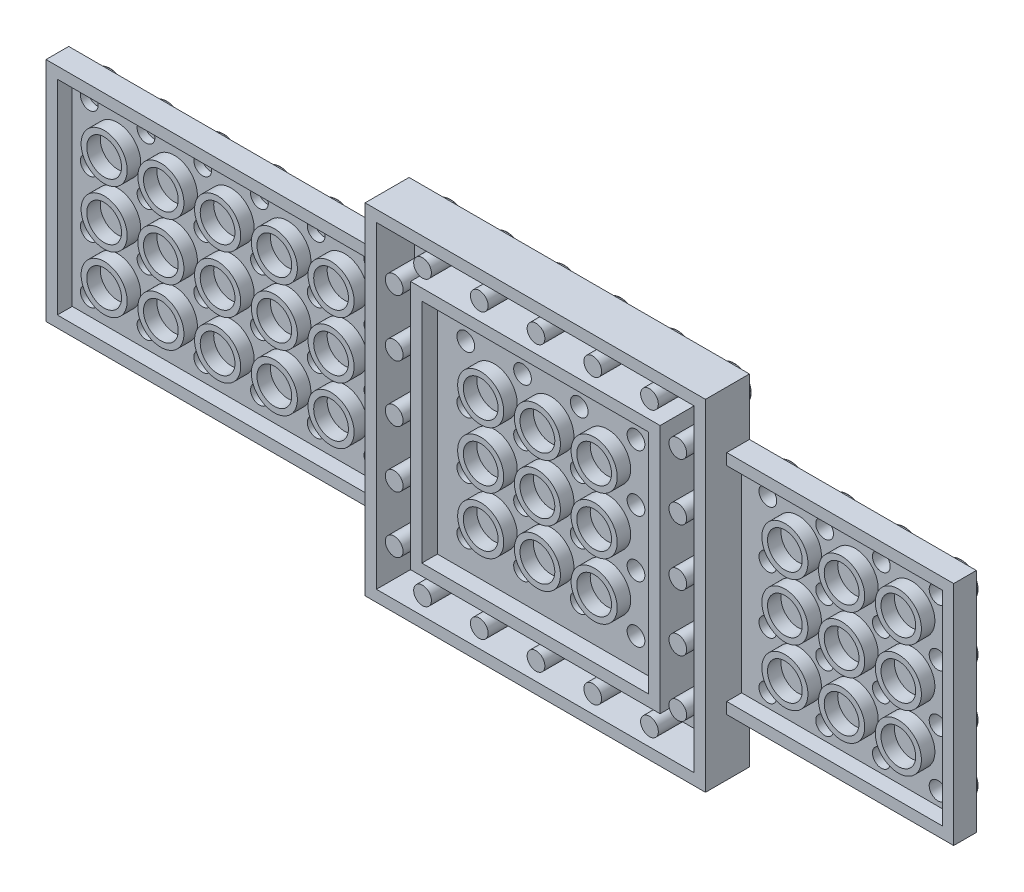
SolidWorks part; units mm, degrees
ref_plane "Vorne" through (0, 0, 0) normal (0, 0, 1) x (1, 0, 0)
ref_plane "Oben" through (0, 0, 0) normal (0, 1, 0) x (1, 0, 0)
ref_plane "Rechts" through (0, 0, 0) normal (1, 0, 0) x (0, 0, -1)
sketch "Skizze1" plane through (0, 0, 0) normal (0, 0, 1) x (1, 0, 0)
  line L0 (-31.7, 0.5) -> (-31.7, -7.5)
  line L1 (-31.7, 0.5) -> (-79.7, 0.5)
  line L2 (0.3, -7.5) -> (0.3, -39.5)
  line L3 (-31.7, -47.5) -> (-79.7, -47.5)
  line L4 (-127.7, -7.5) -> (-127.7, -39.5)
  line L5 (-31.7, -7.5) -> (0.3, -7.5)
  line L6 (-79.7, 0.5) -> (-79.7, -7.5)
  line L7 (-79.7, -7.5) -> (-127.7, -7.5)
  line L9 (-31.7, -39.5) -> (0.3, -39.5)
  line L10 (-31.7, -47.5) -> (-31.7, -39.5)
  line L11 (-79.7, -39.5) -> (-127.7, -39.5)
  line L12 (-79.7, -47.5) -> (-79.7, -39.5)
  dimension "D1" = 128
  dimension "D2" = 8
  dimension "D3" = 8
  dimension "D4" = 32
  dimension "D5" = 8
  dimension "D6" = 48
  dimension "D7" = 32
  dimension "D8" = 8
  dimension "D9" = 32
  dimension "D10" = 48
extrude "Linear austragen1" add sketch "Skizze1" along normal blind 3.2
sketch "Skizze2" plane through (0, 0, 3.2) normal (0, 0, 1) x (1, 0, 0)
  line L1 (-1.3, -37.9) -> (-33.3, -37.9)
  line L2 (-1.3, -37.9) -> (-1.3, -9.1)
  line L3 (-1.3, -9.1) -> (-33.3, -9.1)
  line L4 (-126.1, -37.9) -> (-126.1, -9.1)
  line L5 (0.3, -39.5) -> (0.3, -7.5) construction
  line L7 (0.3, -7.5) -> (-31.7, -7.5) construction
  line L9 (-31.7, -39.5) -> (0.3, -39.5) construction
  line L11 (-127.7, -7.5) -> (-127.7, -39.5) construction
  line L12 (-33.3, -9.1) -> (-33.3, -1.1)
  line L13 (-33.3, -1.1) -> (-78.1, -1.1)
  line L14 (-78.1, -1.1) -> (-78.1, -9.1)
  line L15 (-33.3, -37.9) -> (-33.3, -45.9)
  line L16 (-33.3, -45.9) -> (-78.1, -45.9)
  line L17 (-78.1, -45.9) -> (-78.1, -37.9)
  line L18 (-31.7, -7.5) -> (-31.7, 0.5) construction
  line L19 (-79.7, 0.5) -> (-79.7, -7.5) construction
  line L20 (-31.7, 0.5) -> (-79.7, 0.5) construction
  line L21 (-79.7, -47.5) -> (-31.7, -47.5) construction
  line L22 (-78.1, -37.9) -> (-126.1, -37.9)
  line L23 (-78.1, -9.1) -> (-126.1, -9.1)
  dimension "D1" = 1.6
  dimension "D2" = 1.6
  dimension "D3" = 1.6
  dimension "D4" = 1.6
  dimension "D5" = 1.6
  dimension "D6" = 1.6
  dimension "D7" = 1.6
  dimension "D8" = 1.6
extrude "Schnitt-Linear austragen1" cut sketch "Skizze2" against normal blind 2.1
sketch "Skizze3" plane through (0, 0, 1.1) normal (0, 0, 1) x (1, 0, 0)
  line L0 (0.3, -39.5) -> (0.3, -7.5) construction
  line L2 (0.3, -7.5) -> (-31.7, -7.5) construction
  circle A0 centre (-7.7, -15.5) radius 3.25
  circle A1 centre (-7.7, -15.5) radius 2.45
  dimension "D1" = 6.5
  dimension "D2" = 4.9
  dimension "D3" = 8
  dimension "D4" = 8
extrude "Linear austragen2" add sketch "Skizze3" along normal blind 1.9
sketch "Skizze4" plane through (0, 0, 0) normal (0, 0, -1) x (-1, 0, 0)
  line L1 (-0.3, -39.5) -> (-0.3, -7.5) construction
  line L2 (-0.3, -7.5) -> (31.7, -7.5) construction
  circle A0 centre (3.7, -11.5) radius 2.45
  dimension "D1" = 4.9
  dimension "D2" = 4
  dimension "D3" = 4
extrude "Linear austragen3" add sketch "Skizze4" along normal blind 1.9
fillet "Verrundung1" radius 0.2 1 edges at (-6.15, -11.5, -1.9)
sketch "Skizze5" plane through (0, 0, 1.1) normal (0, 0, 1) x (1, 0, 0)
  circle A0 centre (-4, -12) radius 1.25
  dimension "D1" = 2.5
extrude "Schnitt-Linear austragen2" cut sketch "Skizze5" against normal blind 1.8
pattern_linear "Lineares Muster1" count 4 spacing 8 along (0, -1, 0) count 4 spacing 8 along (-1, 0, 0) of "Schnitt-Linear austragen2", "Verrundung1", "Linear austragen3"
pattern_linear "Lineares Muster4" count 3 spacing 8 along (0, -1, 0) count 3 spacing 8 along (-1, 0, 0) of "Linear austragen2"
sketch "Skizze6" plane through (0, 0, 1.1) normal (0, 0, 1) x (1, 0, 0)
  line L0 (-127.7, -7.5) -> (-127.7, -39.5) construction
  line L1 (-79.7, -7.5) -> (-127.7, -7.5) construction
  circle A0 centre (-123.7, -11.5) radius 1.25
  dimension "D1" = 2.5
  dimension "D2" = 4
  dimension "D3" = 4
extrude "Schnitt-Linear austragen3" cut sketch "Skizze6" against normal blind 1.8
sketch "Skizze7" plane through (0, 0, 0) normal (0, 0, -1) x (-1, 0, 0)
  line L0 (127.7, -7.5) -> (127.7, -39.5) construction
  line L1 (79.7, -7.5) -> (127.7, -7.5) construction
  circle A0 centre (123.7, -11.5) radius 2.45
  dimension "D1" = 4.9
  dimension "D2" = 4
  dimension "D3" = 4
extrude "Linear austragen4" add sketch "Skizze7" along normal blind 1.9
fillet "Verrundung2" radius 0.2 1 edges at (-126.15, -11.5, -1.9)
pattern_linear "Lineares Muster5" count 4 spacing 8 along (0, -1, 0) count 6 spacing 8 along (1, 0, 0) of "Verrundung2", "Linear austragen4", "Schnitt-Linear austragen3"
sketch "Skizze8" plane through (0, 0, 1.1) normal (0, 0, 1) x (1, 0, 0)
  line L0 (-127.7, -39.5) -> (-79.7, -39.5) construction
  line L1 (-127.7, -7.5) -> (-127.7, -39.5) construction
  circle A0 centre (-119.7, -31.5) radius 3.25
  circle A1 centre (-119.7, -31.5) radius 2.45
  dimension "D1" = 6.5
  dimension "D2" = 4.9
  dimension "D3" = 8
  dimension "D4" = 8
extrude "Linear austragen5" add sketch "Skizze8" along normal blind 1.9
pattern_linear "Lineares Muster6" count 3 spacing 8 along (0, 1, 0) count 5 spacing 8 along (1, 0, 0) of "Linear austragen5"
sketch "Skizze9" plane through (0, 0, 0) normal (0, 0, -1) x (-1, 0, 0)
  line L0 (79.7, -47.5) -> (31.7, -47.5) construction
  line L1 (31.7, 0.5) -> (79.7, 0.5) construction
  line L5 (71.7, -7.5) -> (39.7, -7.5)
  line L6 (71.7, -7.5) -> (71.7, -39.5)
  line L7 (71.7, -39.5) -> (39.7, -39.5)
  line L8 (39.7, -7.5) -> (39.7, -39.5)
  line L9 (31.7, -47.5) -> (31.7, -39.5) construction
  line L10 (79.7, -39.5) -> (79.7, -47.5) construction
  point P10 (31.7, -43.5)
  dimension "D1" = 8
  dimension "D2" = 8
  dimension "D3" = 8
  dimension "D4" = 8
extrude "Schnitt-Linear austragen4" cut sketch "Skizze9" against normal blind 3.2
sketch "Skizze10" plane through (0, 0, 1.1) normal (0, 0, 1) x (1, 0, 0)
  line L0 (-78.1, -1.1) -> (-78.1, -9.1) construction
  line L1 (-79.7, 0.5) -> (-31.7, 0.5)
  line L2 (-79.7, 0.5) -> (-79.7, -47.5)
  line L3 (-79.7, -47.5) -> (-31.7, -47.5)
  line L4 (-31.7, 0.5) -> (-31.7, -47.5)
  line L5 (-33.3, -1.1) -> (-78.1, -1.1) construction
  line L6 (-33.3, -9.1) -> (-33.3, -1.1) construction
  line L7 (-78.1, -45.9) -> (-33.3, -45.9) construction
  point P7 (-78.1, -5.1)
  dimension "D1" = 1.6
  dimension "D2" = 1.6
  dimension "D3" = 1.6
  dimension "D4" = 1.6
extrude "Linear austragen7" add sketch "Skizze10" along normal blind 5.1
sketch "Skizze11" plane through (0, 0, 6.2) normal (0, 0, 1) x (1, 0, 0)
  line L0 (-31.7, 0.5) -> (-79.7, 0.5) construction
  line L1 (-71.7, -7.5) -> (-39.7, -7.5)
  line L2 (-71.7, -7.5) -> (-71.7, -39.5)
  line L3 (-71.7, -39.5) -> (-39.7, -39.5)
  line L4 (-39.7, -7.5) -> (-39.7, -39.5)
  line L5 (-79.7, -47.5) -> (-31.7, -47.5) construction
  line L6 (-31.7, -47.5) -> (-31.7, 0.5) construction
  line L7 (-79.7, 0.5) -> (-79.7, -47.5) construction
  dimension "D1" = 8
  dimension "D2" = 8
  dimension "D3" = 8
  dimension "D4" = 8
extrude "Schnitt-Linear austragen5" cut sketch "Skizze11" against normal blind 2.2
sketch "Skizze12" plane through (0, 0, 6.2) normal (0, 0, 1) x (1, 0, 0)
  line L0 (-79.7, -47.5) -> (-31.7, -47.5) construction
  line L1 (-73.3, -41.1) -> (-38.1, -41.1)
  line L2 (-73.3, -41.1) -> (-73.3, -5.9)
  line L3 (-73.3, -5.9) -> (-38.1, -5.9)
  line L4 (-38.1, -41.1) -> (-38.1, -5.9)
  line L5 (-78.1, -45.9) -> (-33.3, -45.9)
  line L6 (-78.1, -45.9) -> (-78.1, -1.1)
  line L7 (-78.1, -1.1) -> (-33.3, -1.1)
  line L8 (-33.3, -45.9) -> (-33.3, -1.1)
  line L9 (-79.7, 0.5) -> (-79.7, -47.5) construction
  line L10 (-31.7, -47.5) -> (-31.7, 0.5) construction
  line L11 (-31.7, 0.5) -> (-79.7, 0.5) construction
  line L12 (-39.7, -7.5) -> (-71.7, -7.5) construction
  line L13 (-39.7, -39.5) -> (-39.7, -7.5) construction
  line L14 (-71.7, -39.5) -> (-39.7, -39.5) construction
  line L15 (-71.7, -7.5) -> (-71.7, -39.5) construction
  dimension "D1" = 1.6
  dimension "D2" = 1.6
  dimension "D3" = 1.6
  dimension "D4" = 1.6
  dimension "D5" = 1.6
  dimension "D6" = 1.6
  dimension "D7" = 1.6
  dimension "D8" = 1.6
extrude "Schnitt-Linear austragen6" cut sketch "Skizze12" against normal blind 5.4
sketch "Skizze13" plane through (0, 0, 0) normal (0, 0, -1) x (-1, 0, 0)
  line L0 (79.7, -47.5) -> (31.7, -47.5) construction
  line L1 (31.7, -47.5) -> (31.7, -39.5) construction
  circle A0 centre (35.7, -43.5) radius 2.45
  dimension "D1" = 4.9
  dimension "D3" = 4
  dimension "D2" = 4
extrude "Linear austragen8" add sketch "Skizze13" along normal blind 1.9
fillet "Verrundung3" radius 0.2 1 edges at (-38.15, -43.5, -1.9)
sketch "Skizze14" plane through (0, 0, 0.8) normal (0, 0, 1) x (1, 0, 0)
  line L0 (-79.7, -47.5) -> (-31.7, -47.5) construction
  line L1 (-31.7, -47.5) -> (-31.7, 0.5) construction
  circle A0 centre (-35.7, -43.5) radius 1.25
  dimension "D1" = 2.5
  dimension "D2" = 4
  dimension "D3" = 4
extrude "Schnitt-Linear austragen7" cut sketch "Skizze14" against normal blind 1.8
pattern_linear "Lineares Muster7" count 6 spacing 8 along (0, 1, 0) of "Schnitt-Linear austragen7", "Verrundung3", "Linear austragen8"
pattern_linear "Lineares Muster8" count 6 spacing 8 along (-1, 0, 0) of "Schnitt-Linear austragen7", "Verrundung3", "Linear austragen8"
sketch "Skizze15" plane through (0, 0, 0) normal (0, 0, -1) x (-1, 0, 0)
  line L0 (31.7, 0.5) -> (79.7, 0.5) construction
  line L1 (79.7, 0.5) -> (79.7, -7.5) construction
  circle A0 centre (75.7, -3.5) radius 2.45
  dimension "D1" = 4
  dimension "D2" = 4
extrude "Linear austragen9" add sketch "Skizze15" along normal blind 1.9
fillet "Verrundung4" radius 0.2 1 edges at (-78.15, -3.5, -1.9)
sketch "Skizze16" plane through (0, 0, 0.8) normal (0, 0, 1) x (1, 0, 0)
  line L0 (-31.7, 0.5) -> (-79.7, 0.5) construction
  line L1 (-79.7, 0.5) -> (-79.7, -47.5) construction
  circle A0 centre (-75.7, -3.5) radius 1.25
  dimension "D1" = 4
  dimension "D2" = 4
extrude "Schnitt-Linear austragen8" cut sketch "Skizze16" against normal blind 1.8
pattern_linear "Lineares Muster12" count 5 spacing 8 along (0, -1, 0) of "Schnitt-Linear austragen8", "Verrundung4", "Linear austragen9"
pattern_linear "Lineares Muster13" count 5 spacing 8 along (1, 0, 0) of "Schnitt-Linear austragen8", "Verrundung4", "Linear austragen9"
sketch "Skizze17" plane through (0, 0, 0.8) normal (0, 0, 1) x (1, 0, 0)
  line L0 (-79.7, -47.5) -> (-31.7, -47.5) construction
  line L1 (-79.7, 0.5) -> (-79.7, -47.5) construction
  circle A0 centre (-75.7, -39.5) radius 1.25
  dimension "D1" = 8
  dimension "D3" = 2.5
  dimension "D2" = 4
extrude "Linear austragen10" add sketch "Skizze17" along normal blind 5.3
pattern_linear "Lineares Muster14" count 5 spacing 8 along (0, 1, 0) of "Linear austragen10"
sketch "Skizze18" plane through (0, 0, 0.8) normal (0, 0, 1) x (1, 0, 0)
  line L0 (-31.7, 0.5) -> (-79.7, 0.5) construction
  line L1 (-79.7, 0.5) -> (-79.7, -47.5) construction
  circle A0 centre (-71.7, -3.5) radius 1.25
  dimension "D1" = 4
  dimension "D3" = 2.5
  dimension "D2" = 8
extrude "Linear austragen11" add sketch "Skizze18" along normal blind 5.3
pattern_linear "Lineares Muster15" count 5 spacing 8 along (1, 0, 0) of "Linear austragen11"
sketch "Skizze19" plane through (0, 0, 0.8) normal (0, 0, 1) x (1, 0, 0)
  line L0 (-31.7, -47.5) -> (-31.7, 0.5) construction
  line L1 (-31.7, 0.5) -> (-79.7, 0.5) construction
  circle A0 centre (-35.7, -7.5) radius 1.25
  dimension "D1" = 4
  dimension "D2" = 8
extrude "Linear austragen12" add sketch "Skizze19" along normal blind 5.3
pattern_linear "Lineares Muster16" count 5 spacing 8 along (0, -1, 0) of "Linear austragen12"
sketch "Skizze20" plane through (0, 0, 0.8) normal (0, 0, 1) x (1, 0, 0)
  line L0 (-79.7, -47.5) -> (-31.7, -47.5) construction
  line L1 (-31.7, -47.5) -> (-31.7, 0.5) construction
  circle A0 centre (-39.7, -43.5) radius 1.25
  dimension "D1" = 4
  dimension "D2" = 8
extrude "Linear austragen13" add sketch "Skizze20" along normal blind 5.3
pattern_linear "Lineares Muster17" count 5 spacing 8 along (-1, 0, 0) of "Linear austragen13"
sketch "Skizze21" plane through (0, 0, 4) normal (0, 0, 1) x (1, 0, 0)
  line L2 (-39.7, -39.5) -> (-39.7, -7.5) construction
  line L3 (-71.7, -39.5) -> (-39.7, -39.5) construction
  circle A0 centre (-47.7, -31.5) radius 3.25
  circle A1 centre (-47.7, -31.5) radius 2.45
  dimension "D1" = 6.5
  dimension "D2" = 4.9
  dimension "D3" = 8
  dimension "D4" = 8
extrude "Linear austragen14" add sketch "Skizze21" along normal blind 1.9
pattern_linear "Lineares Muster18" count 3 spacing 8 along (0, 1, 0) count 3 spacing 8 along (-1, 0, 0) of "Linear austragen14"
sketch "Skizze22" plane through (0, 0, 0) normal (0, 0, -1) x (-1, 0, 0)
  line L2 (71.7, -7.5) -> (71.7, -39.5) construction
  line L3 (39.7, -7.5) -> (71.7, -7.5)
  line L4 (39.7, -7.5) -> (39.7, -39.5)
  line L5 (39.7, -39.5) -> (71.7, -39.5)
  line L6 (71.7, -7.5) -> (71.7, -39.5)
  line L7 (79.7, -47.5) -> (31.7, -47.5) construction
  line L8 (31.7, 0.5) -> (79.7, 0.5) construction
  line L9 (31.7, -7.5) -> (31.7, 0.5) construction
  point P0 (31.7, -3.5)
  dimension "D1" = 8
  dimension "D3" = 8
  dimension "D4" = 8
extrude "Schnitt-Linear austragen9" cut sketch "Skizze22" against normal blind 3.2
sketch "Skizze23" plane through (0, 0, 3.2) normal (0, 0, -1) x (-1, 0, 0)
  line L1 (71.7, -7.5) -> (39.7, -7.5) construction
  line L2 (71.7, -39.5) -> (71.7, -7.5) construction
  circle A0 centre (67.7, -11.5) radius 2.45
  dimension "D1" = 4
  dimension "D2" = 4
extrude "Linear austragen15" add sketch "Skizze23" along normal blind 1.9
fillet "Verrundung5" radius 0.2 1 edges at (-70.15, -11.5, 1.3)
sketch "Skizze24" plane through (0, 0, 4) normal (0, 0, 1) x (1, 0, 0)
  line L2 (-71.7, -7.5) -> (-39.7, -7.5) construction
  line L3 (-71.7, -39.5) -> (-71.7, -7.5) construction
  circle A0 centre (-67.7, -11.5) radius 1.25
  dimension "D1" = 4
  dimension "D2" = 4
extrude "Schnitt-Linear austragen10" cut sketch "Skizze24" against normal blind 1.8
pattern_linear "Lineares Muster19" count 4 spacing 8 along (1, 0, 0) count 4 spacing 8 along (0, -1, 0) of "Linear austragen15", "Verrundung5", "Schnitt-Linear austragen10"
